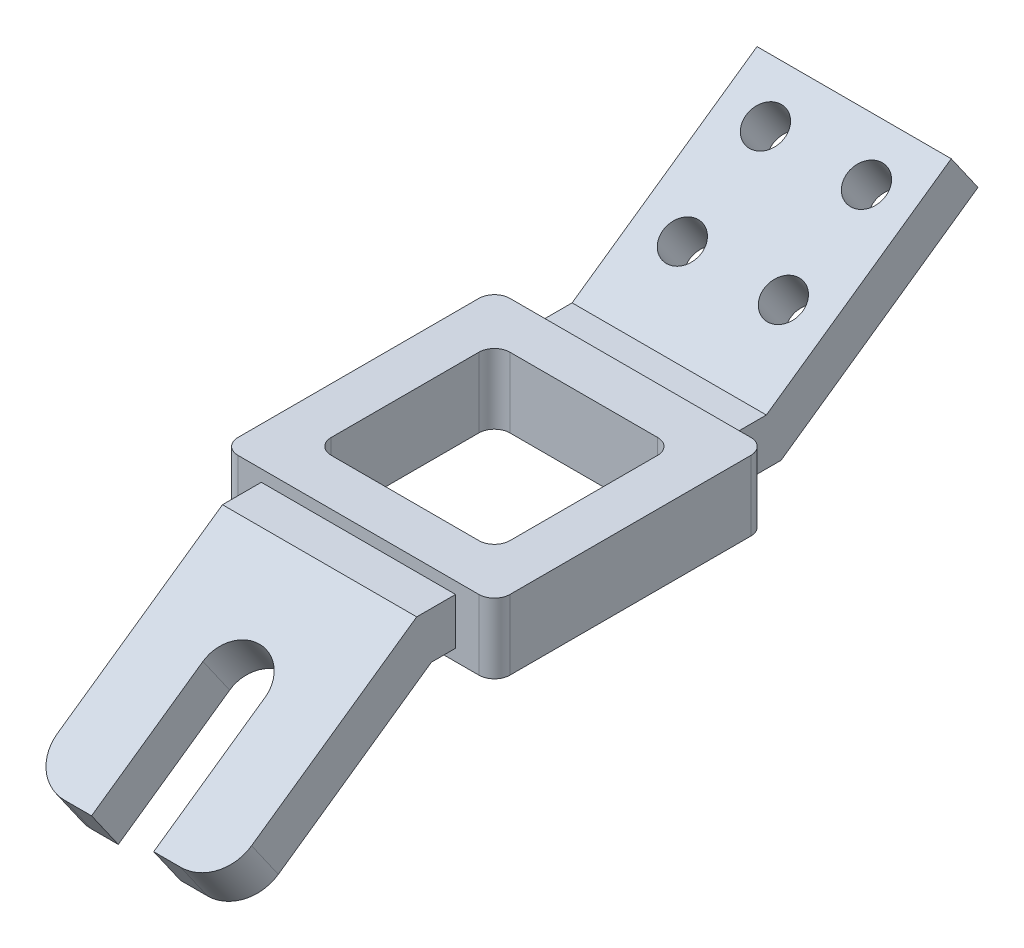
SolidWorks part; units mm, degrees
ref_plane "Front" through (0, 0, 0) normal (0, 0, 1) x (1, 0, 0)
ref_plane "Top" through (0, 0, 0) normal (0, 1, 0) x (1, 0, 0)
ref_plane "Right" through (0, 0, 0) normal (1, 0, 0) x (0, 0, -1)
sketch "Sketch1" plane through (0, 0, 0) normal (1, 0, 0) x (0, 0, -1)
  line L0 (-119.5694, -43.7065) -> (-57.15, 0)
  line L1 (-57.15, 0) -> (57.15, 0)
  line L2 (57.15, 0) -> (119.5694, 43.7065)
  dimension "D1" = 114.3
  dimension "D2" = 76.2
  dimension "D3" = 76.2
  dimension "D4" = 145
  dimension "D5" = 145
extrude "Extrude-Thin1" add sketch "Sketch1" along normal mid plane 63.5 thin
sketch "Sketch2" plane through (0, 0, 0) normal (0, 1, 0) x (1, 0, 0)
  line L0 (-31.75, -59.5526) -> (-31.75, 54.7474) construction
  line L1 (-44.45, 42.0474) -> (44.45, 42.0474)
  line L2 (-44.45, 42.0474) -> (-44.45, -46.8526)
  line L3 (-44.45, -46.8526) -> (44.45, -46.8526)
  line L4 (44.45, 42.0474) -> (44.45, -46.8526)
  line L5 (31.75, -59.5526) -> (31.75, 54.7474) construction
  line L6 (31.75, 54.7474) -> (-31.75, 54.7474) construction
  line L7 (31.75, -59.5526) -> (-31.75, -59.5526) construction
  dimension "D1" = 12.7
  dimension "D2" = 12.7
  dimension "D3" = 12.7
  dimension "D4" = 12.7
extrude "Extrude1" add sketch "Sketch2" along normal mid plane 22.86
fillet "Fillet1" radius 5.08 4 edges at (-44.45, 0, 46.8526) (44.45, 0, -42.0474) (-44.45, 0, -42.0474) (44.45, 0, 46.8526)
sketch "Sketch3" plane through (0, 11.43, 0) normal (0, 1, 0) x (-1, 0, 0)
  line L8 (29.21, -26.8074) -> (29.21, 31.6126)
  line L9 (29.21, 31.6126) -> (-29.21, 31.6126)
  line L10 (-29.21, 31.6126) -> (-29.21, -26.8074)
  line L11 (-29.21, -26.8074) -> (29.21, -26.8074)
  line L12 (29.21, -26.8074) -> (29.21, 31.6126)
  line L13 (29.21, 31.6126) -> (-29.21, 31.6126)
  line L14 (-29.21, 31.6126) -> (-29.21, -26.8074)
  line L15 (-29.21, -26.8074) -> (29.21, -26.8074)
  dimension "D1" = 15.24
extrude "Cut-Extrude1" cut sketch "Sketch3" against normal through all
fillet "Fillet2" radius 5.08 4 edges at (-29.21, 0, -26.8074) (29.21, 0, -26.8074) (29.21, 0, 31.6126) (-29.21, 0, 31.6126)
fillet "Fillet3" radius 12.7 2 edges at (31.75, -43.7065, 119.5694) (-31.75, -43.7065, 119.5694)
sketch "Sketch4" plane through (0, 33.0937, 23.1724) normal (0, 0.8192, 0.5736) x (-1, 0, 0)
  line L0 (0, 123.0145) -> (0, 75.7084) construction
  line L1 (-19.05, 123.0145) -> (19.05, 123.0145) construction
  line L2 (10.16, 123.0145) -> (10.16, 78.5645)
  line L3 (-10.16, 78.5645) -> (-10.16, 123.0145)
  line L4 (-10.16, 123.0145) -> (10.16, 123.0145)
  arc A0 (10.16, 78.5645) -> (-10.16, 78.5645) centre (0, 78.5645) cw
  dimension "D1" = 10.16
  dimension "D2" = 44.45
extrude "Cut-Extrude2" cut sketch "Sketch4" against normal through all
sketch "Sketch5" plane through (0, -20.6098, -14.4311) normal (0, 0.8192, 0.5736) x (-1, 0, 0)
  line L0 (-16.51, -107.7745) -> (-16.51, -74.6171) construction
  line L1 (-16.51, -74.6171) -> (16.51, -74.6171) construction
  line L2 (16.51, -74.6171) -> (16.51, -107.7745) construction
  line L3 (16.51, -107.7745) -> (-16.51, -107.7745) construction
  line L4 (-31.75, -123.0145) -> (31.75, -123.0145) construction
  line L5 (-31.75, -49.2171) -> (31.75, -49.2171) construction
  line L6 (-31.75, -49.2171) -> (-31.75, -123.0145) construction
  line L7 (31.75, -49.2171) -> (31.75, -123.0145) construction
  circle A0 centre (-16.51, -107.7745) radius 6.35
  circle A1 centre (-16.51, -74.6171) radius 6.35
  circle A2 centre (16.51, -107.7745) radius 6.35
  circle A3 centre (16.51, -74.6171) radius 6.35
  dimension "D5" = 12.7
  dimension "D1" = 15.24
  dimension "D2" = 25.4
  dimension "D3" = 15.24
  dimension "D4" = 15.24
extrude "4 hole cut" cut sketch "Sketch5" against normal through all
sketch "Sketch6" plane through (0, -20.6098, -14.4311) normal (0, 0.8192, 0.5736) x (-1, 0, 0)
  line L0 (-31.75, -86.1158) -> (31.75, -86.1158) construction
  line L1 (-31.75, -49.2171) -> (-31.75, -123.0145) construction
  line L2 (31.75, -49.2171) -> (31.75, -123.0145) construction
  line L3 (0, -49.2171) -> (-31.75, -123.0145) construction
  line L4 (-31.75, -49.2171) -> (31.75, -49.2171) construction
  line L5 (0, -49.2171) -> (31.75, -123.0145) construction
  circle A0 centre (-15.875, -86.1158) radius 6.35
  circle A1 centre (15.875, -86.1158) radius 6.35
  dimension "D1" = 12.7
extrude "2 hole cut" cut sketch "Sketch6" against normal through all
